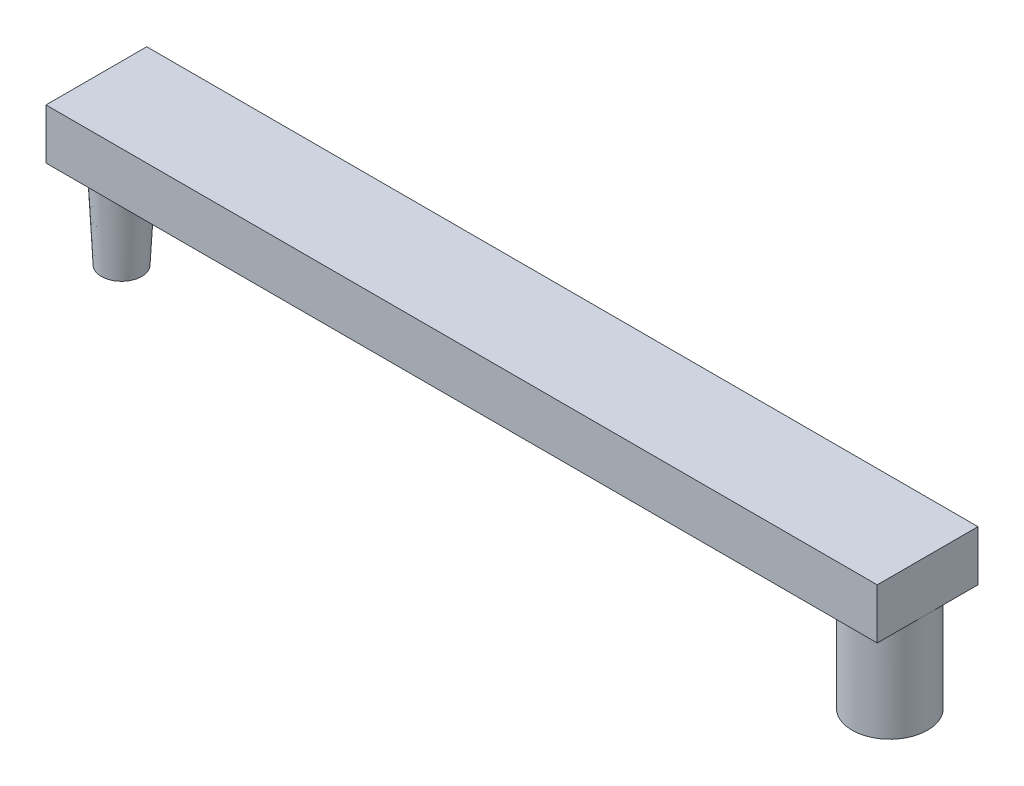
SolidWorks part; units mm, degrees
ref_plane "Alzado" through (0, 0, 0) normal (0, 0, 1) x (1, 0, 0)
ref_plane "Planta" through (0, 0, 0) normal (0, 1, 0) x (1, 0, 0)
ref_plane "Vista lateral" through (0, 0, 0) normal (1, 0, 0) x (0, 0, -1)
sketch "Croquis2" plane through (0, 0, 0) normal (0, 1, 0) x (1, 0, 0)
  line L1 (-8.25, -1) -> (8.25, -1)
  line L2 (-8.25, -1) -> (-8.25, 1)
  line L3 (-8.25, 1) -> (8.25, 1)
  line L4 (8.25, -1) -> (8.25, 1)
  line L5 (-8.25, -1) -> (8.25, 1) construction
  line L6 (-8.25, 1) -> (8.25, -1) construction
  point P0 (0, 0)
  dimension "D1" = 2
  dimension "D2" = 16.5
extrude "Saliente-Extruir2" add sketch "Croquis2" along normal blind 1
sketch "Croquis3" plane through (0, 0, 0) normal (0, -1, 0) x (1, 0, 0)
  line L0 (-8.25, 0) -> (8.25, 0) construction
  line L1 (-8.25, -1) -> (-8.25, 1) construction
  line L2 (8.25, 1) -> (8.25, -1) construction
  circle A0 centre (7.5, 0) radius 0.75
  circle A1 centre (-7.75, 0) radius 0.5
  point P10 (0, 0)
  dimension "D1" = 1.5
  dimension "D2" = 1
extrude "Saliente-Extruir3" add sketch "Croquis3" along normal blind 2
sketch "Croquis4" plane through (0, 0, 0) normal (0, 0, 1) x (1, 0, 0)
  line L0 (-8.15, -2) -> (-8.25, -2)
  line L1 (-8.25, -2) -> (-8.25, 0)
  line L3 (-8.25, 0) -> (-8.15, -2)
  line L4 (-7.25, 0) -> (-7.25, -2)
  line L5 (-7.25, 0) -> (-7.35, -2)
  line L8 (-7.25, -2) -> (-7.35, -2)
  line L9 (-7.75, 0) -> (-7.75, -2) construction
  line L10 (-8.25, 0) -> (-7.25, 0) construction
  line L11 (-8.25, -2) -> (-7.25, -2) construction
  dimension "D1" = 0.1
  dimension "D2" = 0.1
revolve "Cortar-Revolución2" cut sketch "Croquis4" angle 360 about L9
equation "\"`5.5\"=16"
